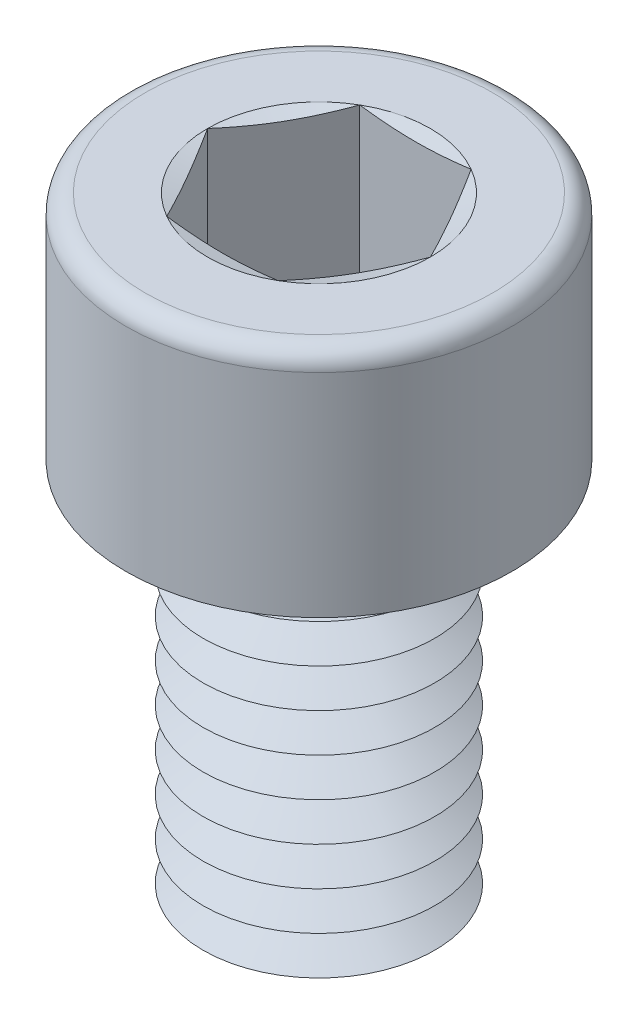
SolidWorks part; units mm, degrees
ref_plane "Front Plane" through (0, 0, 0) normal (0, 0, 1) x (1, 0, 0)
ref_plane "Top Plane" through (0, 0, 0) normal (0, 1, 0) x (1, 0, 0)
ref_plane "Right Plane" through (0, 0, 0) normal (1, 0, 0) x (0, 0, -1)
sketch "Sketch1" plane through (0, 0, 0) normal (0, 1, 0) x (1, 0, 0)
  circle A0 centre (0, 0) radius 3
  dimension "D1" = 6
extrude "Extrude1" add sketch "Sketch1" along normal blind 10
sketch "Sketch2" plane through (0, 10, 0) normal (0, 1, 0) x (1, 0, 0)
  circle A0 centre (0, 0) radius 5
  dimension "D1" = 10
extrude "Extrude2" add sketch "Sketch2" along normal blind 6
sketch "Sketch3" plane through (0, 16, 0) normal (0, 1, 0) x (1, 0, 0)
  line L1 (1.4434, 2.5) -> (-1.4434, 2.5)
  line L2 (-1.4434, 2.5) -> (-2.8868, 0)
  line L3 (-2.8868, 0) -> (-1.4434, -2.5)
  line L4 (-1.4434, -2.5) -> (1.4434, -2.5)
  line L5 (1.4434, -2.5) -> (2.8868, 0)
  line L6 (2.8868, 0) -> (1.4434, 2.5)
  circle A0 centre (0, 0) radius 2.5 construction
  dimension "D1" = 5
extrude "Extrude3" cut sketch "Sketch3" against normal blind 5
fillet "Fillet1" radius 0.5 1 edges at (0, 16, 5)
sketch "Sketch4" plane through (0, 0, 0) normal (1, 0, 0) x (0, 0, -1)
  line L0 (-2.5, 11) -> (0, 11)
  line L1 (0, 11) -> (0, 9.5566)
  line L2 (0, 9.5566) -> (-2.5, 11)
  dimension "D1" = 30
revolve "Cut-Revolve1" cut sketch "Sketch4" angle 360 about L1
sketch "Sketch5" plane through (0, 0, 0) normal (0, 0, 1) x (1, 0, 0)
  line L0 (-3, 0.5) -> (-3, -0.5)
  line L1 (-3, 10) -> (-3, 0) construction
  line L2 (-3, -0.5) -> (-2.134, 0)
  line L3 (-3, 0) -> (3, 0) construction
  line L4 (-2.134, 0) -> (-3, 0.5)
  dimension "D1" = 1
revolve "Cut-Revolve2" cut sketch "Sketch5" angle 360 about axis through (0, 10, 0) along (0, -1, 0)
pattern_linear "LPattern1" count 10 spacing 1 along (0, 1, 0) of "Cut-Revolve2"
sketch "Sketch6" plane through (0, 16, 0) normal (0, 1, 0) x (1, 0, 0)
  circle A0 centre (0, 0) radius 2.8868
extrude "Extrude4" cut sketch "Sketch6" against normal through all draft 75
